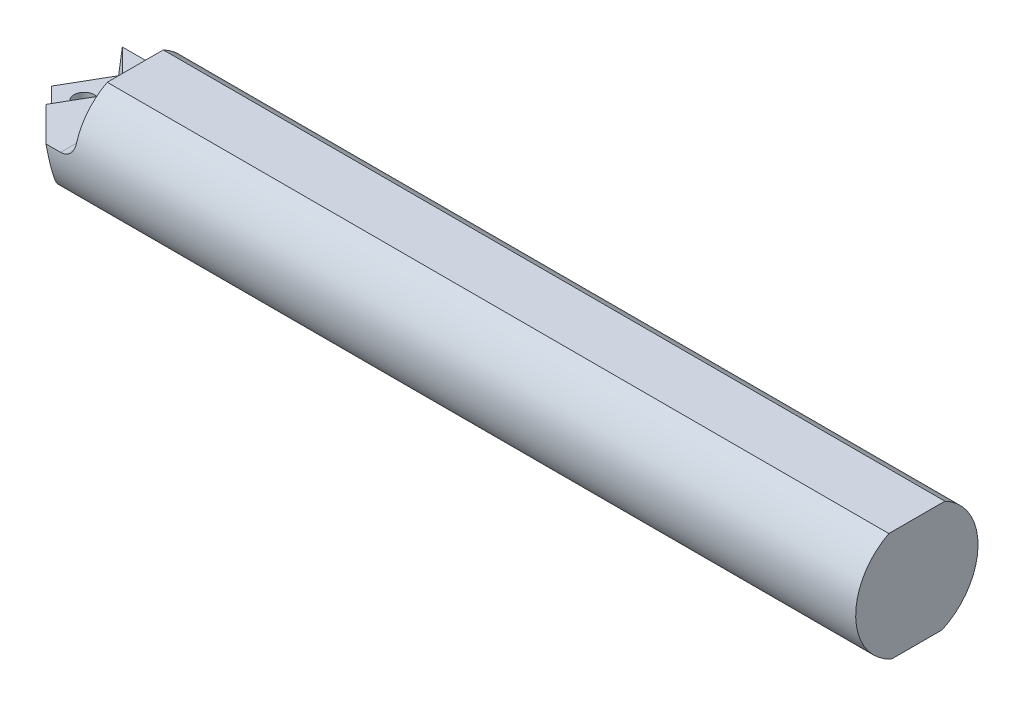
SolidWorks part; units mm, degrees
ref_plane "Front Plane" through (0, 0, 0) normal (0, 0, 1) x (1, 0, 0)
ref_plane "Top Plane" through (0, 0, 0) normal (0, 1, 0) x (1, 0, 0)
ref_plane "Right Plane" through (0, 0, 0) normal (1, 0, 0) x (0, 0, -1)
sketch "Sketch1" plane through (0, 0, 0) normal (1, 0, 0) x (0, 0, -1)
  circle A0 centre (0, 0) radius 9
  dimension "D1" = 18
extrude "Boss-Extrude1" add sketch "Sketch1" along normal mid plane 130
ref_plane "Plane1" through (0, 8, 0) normal (0, 1, 0) x (1, 0, 0)
sketch "Sketch2" plane through (0, 8, 0) normal (0, 1, 0) x (1, 0, 0)
  line L0 (65, 9) -> (-65, 9) construction
  line L1 (-65, 9) -> (65, 9)
  line L2 (-65, 9) -> (-65, -9)
  line L3 (-65, -9) -> (65, -9)
  line L4 (65, 9) -> (65, -9)
  line L5 (-65, -9) -> (65, -9) construction
  line L6 (-65, 9) -> (-65, -9) construction
  line L7 (65, -9) -> (65, 9) construction
  point P4 (0, 0)
extrude "Cut-Extrude1" cut sketch "Sketch2" along normal through all
sketch "Sketch3" plane through (-65, 0, 0) normal (-1, 0, 0) x (0, 0, 1)
  line L0 (-4.1231, 8) -> (4.1231, 8) construction
  line L1 (-9, 8) -> (9, 8)
  line L2 (-9, 8) -> (-9, 0.5)
  line L3 (-9, 0.5) -> (9, 0.5)
  line L4 (9, 8) -> (9, 0.5)
  line L5 (0, 0.5) -> (0, -9) construction
  arc A0 (-4.1231, 8) -> (4.1231, 8) centre (0, 0) ccw construction
  point P11 (0, 2.0265)
  dimension "D1" = 9.5
extrude "Cut-Extrude2" cut sketch "Sketch3" against normal blind 15
sketch "Sketch4" plane through (0, 0.5, 0) normal (0, 1, 0) x (1, 0, 0)
  line L0 (-65, 1.8673) -> (-59.1875, -3.9452)
  line L1 (-65, 8.9861) -> (-65, -8.9861) construction
  line L2 (-59.1875, -3.9452) -> (-55.0775, 3.1736)
  line L3 (-55.0775, 3.1736) -> (-60.89, 8.9861)
  line L4 (-65, 8.9861) -> (-50, 8.9861) construction
  line L5 (-60.89, 8.9861) -> (-65, 1.8673)
  circle A0 centre (-60.0387, 2.5205) radius 3.97 construction
  point P10 (-59.799, 8.9861)
  dimension "D2" = 75
  dimension "D3" = 75
extrude "Cut-Extrude3" cut sketch "Sketch4" against normal blind 3.18 draft 7
ref_plane "Plane3" through (0, -8.2, 0) normal (0, 1, 0) x (1, 0, 0)
sketch "Sketch8" plane through (0, -8.2, 0) normal (0, 1, 0) x (1, 0, 0)
  line L1 (65, 9) -> (-65, 9)
  line L2 (65, 9) -> (65, -9)
  line L3 (65, -9) -> (-65, -9)
  line L4 (-65, 9) -> (-65, -9)
  line L5 (65, 9) -> (-65, 9) construction
  line L6 (-65, -9) -> (65, -9) construction
  line L7 (65, -9) -> (65, 9) construction
  line L8 (-65, 9) -> (-65, -9) construction
extrude "Cut-Extrude6" cut sketch "Sketch8" against normal through all
sketch "Sketch5" plane through (0, -2.68, 0) normal (0, 1, 0) x (1, 0, 0)
  line L0 (-64.5121, 1.9315) -> (-55.5654, 3.1094) construction
  circle A0 centre (-60.0387, 2.5205) radius 1.5
  dimension "D1" = 3
extrude "Cut-Extrude4" cut sketch "Sketch5" against normal through all
sketch "Sketch6" plane through (0, 0.5, 0) normal (0, 1, 0) x (1, 0, 0)
  line L0 (-54.1466, -8.9861) -> (-65, 1.8673)
  line L1 (-65, 1.8673) -> (-60.89, 8.9861)
  line L2 (-65, 1.8673) -> (-59.1875, -3.9452) construction
  line L3 (-60.89, 8.9861) -> (-65, 1.8673) construction
  line L4 (-60.89, 8.9861) -> (-65, 8.9861)
  line L5 (-65, 8.9861) -> (-65, -8.9861)
  line L6 (-65, -8.9861) -> (-54.1466, -8.9861)
  line L7 (-65, 8.9861) -> (-60.89, 8.9861) construction
  line L8 (-50, -8.9861) -> (-65, -8.9861) construction
  line L9 (-65, 1.8673) -> (-65, -8.9861) construction
  point P8 (-68.7614, -13.8029)
extrude "Cut-Extrude5" cut sketch "Sketch6" against normal through all draft 10 contours L0 M11 M9 M10 | L4 L5 L1
ref_plane "Plane2" through (0, -8, 0) normal (0, 1, 0) x (1, 0, 0)
fillet "Fillet1" radius 2 1 edges at (-50, 0.5, 0)
sketch "Sketch9" plane through (0, 0.5, 0) normal (0, 1, 0) x (1, 0, 0)
  circle A0 centre (-55.0775, 3.1736) radius 1.5
  dimension "D1" = 3
extrude "Cut-Extrude7" cut sketch "Sketch9" along direction (0, 1, 0) on the side against the normal blind 3.18
equation "\"toolDia\"= 18mm"
equation "\"inCir\" = 7.94mm"
equation "\"inHeight\"= 3.18"
equation "\"flatHeight\" = 2.5mm"
equation "\"topAngle\" = 45deg"
equation "\"toolLength\"= 130mm"
equation "\"heightAboveCentre\"= 0.5mm"
equation "\"cutPlaneHeight\" = \"toolDia\" / 2 - 1"
equation "\"cutHeight\"= \"toolDia\" / 2 + \"heightAboveCentre\""
equation "\"flatlength\"= 15mm"
equation "\"D1@Cut-Extrude2\"=\"flatlength\""
equation "\"D1@Cut-Extrude3\"=\"inHeight\""
